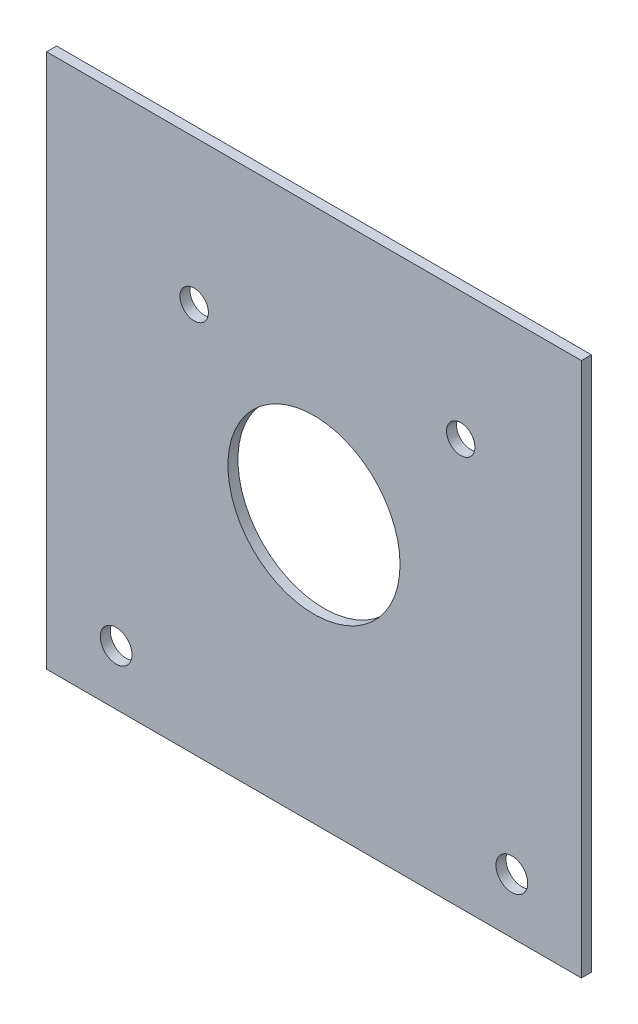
SolidWorks part; units mm, degrees
ref_plane "Front Plane" through (0, 0, 0) normal (0, 0, 1) x (1, 0, 0)
ref_plane "Top Plane" through (0, 0, 0) normal (0, 1, 0) x (1, 0, 0)
ref_plane "Right Plane" through (0, 0, 0) normal (1, 0, 0) x (0, 0, -1)
sketch "Sketch1" plane through (0, 0, 0) normal (0, 0, 1) x (1, 0, 0)
  line L0 (0, 0) -> (0, -80)
  line L5 (-71.7, 90) -> (71.7, -90) construction
  line L6 (-71.7, -90) -> (71.7, 90) construction
  line L7 (-71.7, 0) -> (71.7, 0)
  line L8 (-71.7, 41.6) -> (71.7, 41.6) construction
  line L9 (0, 36.6) -> (-71.7, 36.6) construction
  line L10 (0, 0) -> (0, 80)
  line L11 (-80, -80) -> (80, -80)
  line L12 (-80, 80) -> (80, 80)
  line L13 (-80, 80) -> (-80, -80)
  line L14 (-80, -80) -> (-84.7616, 20)
  line L15 (80, 80) -> (80, -80)
  circle A1 centre (0, 0) radius 25.75
  circle A2 centre (43.9, 41.6) radius 4.25
  circle A3 centre (-35.85, 36.6) radius 4.25
  circle A5 centre (-59.2, -63.5) radius 4.75
  circle A6 centre (59.2, -63.5) radius 4.75
  point P0 (0, 0)
  point P5 (0, 41.6)
  point P9 (0, 0)
  point P12 (0, 0)
  point P15 (43.9, 41.6)
  point P18 (0, 41.6)
  point P19 (-52.8201, 0)
  point P22 (0, 36.6)
  point P25 (-36.2, 36.6)
  point P28 (-59.2, -63.5)
  point P36 (0, -80)
  point P39 (0, 80)
  dimension "D1" = 180
  dimension "D4" = 51.5
  dimension "D6" = 8.5
  dimension "D9" = 8.5
  dimension "D12" = 9.5
  dimension "D2" = 41.6
  dimension "D3" = 143.4
  dimension "D5" = 43.9
  dimension "D7" = 36.6
  dimension "D8" = 36.2
  dimension "D10" = 63.5
  dimension "D11" = 80
  dimension "D13" = 80
  dimension "D14" = 160
  dimension "D15" = 160
extrude "Boss-Extrude3" add sketch "Sketch1" along normal blind 3
